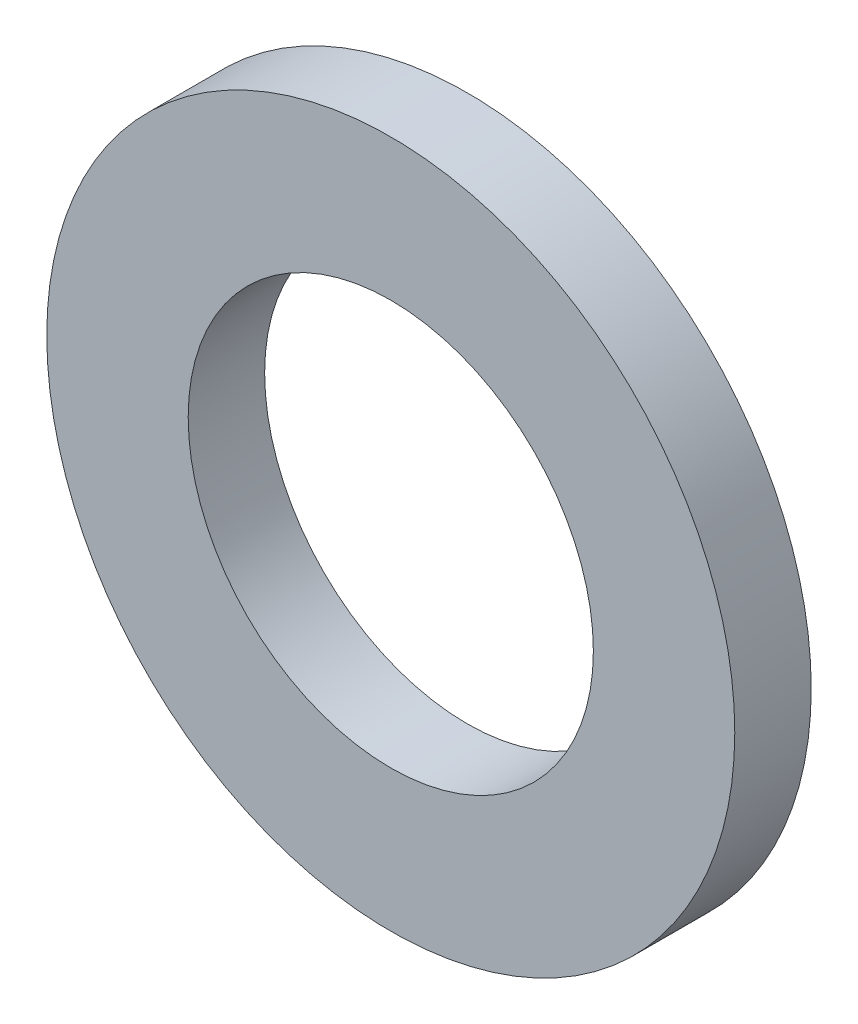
SolidWorks part; units mm, degrees
ref_plane "前视基准面" through (0, 0, 0) normal (0, 0, 1) x (1, 0, 0)
ref_plane "上视基准面" through (0, 0, 0) normal (0, 1, 0) x (1, 0, 0)
ref_plane "右视基准面" through (0, 0, 0) normal (1, 0, 0) x (0, 0, -1)
sketch "草图1" plane through (0, 0, 0) normal (0, 0, 1) x (1, 0, 0)
  circle A0 centre (0, 0) radius 4.5
  circle A1 centre (0, 0) radius 2.65
  dimension "d2" = 9
  dimension "d1" = 5.3
extrude "拉伸1" add sketch "草图1" along normal blind 1
